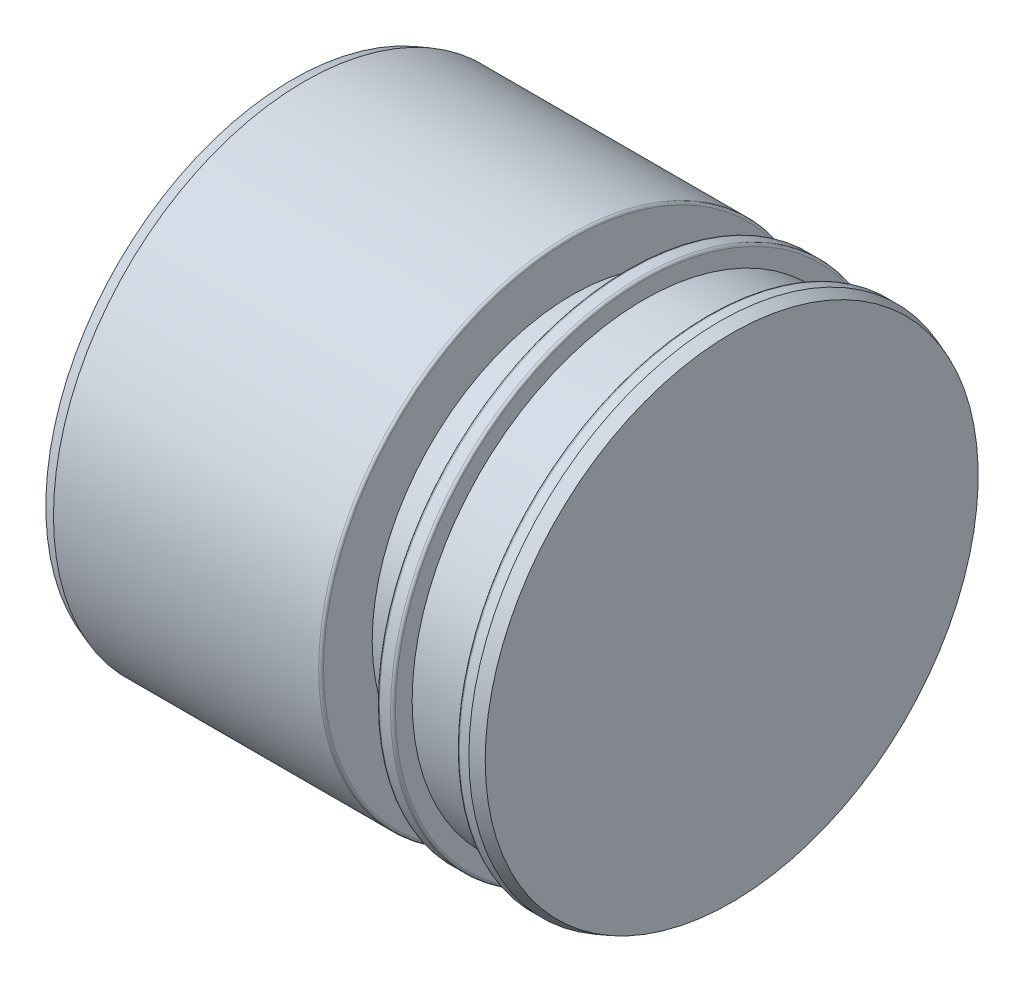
SolidWorks part; units mm, degrees
ref_plane "Face" through (0, 0, 0) normal (0, 0, 1) x (1, 0, 0)
ref_plane "Dessus" through (0, 0, 0) normal (0, 1, 0) x (1, 0, 0)
ref_plane "Droite" through (0, 0, 0) normal (1, 0, 0) x (0, 0, -1)
sketch "Esquisse1" plane through (0, 0, 0) normal (0, 0, 1) x (1, 0, 0)
  line L0 (0, 0) -> (50.2342, 0) construction
  line L1 (0, 0) -> (0, 31.4)
  line L2 (0, 31.4) -> (35, 31.4)
  line L3 (35, 31.4) -> (35, 25)
  line L4 (35, 25) -> (42, 25)
  line L5 (42, 25) -> (42, 31.4)
  line L6 (42, 31.4) -> (44, 31.4)
  line L7 (44, 31.4) -> (44, 29)
  line L8 (44, 29) -> (52, 29)
  line L9 (52, 29) -> (52, 31.4)
  line L10 (52, 31.4) -> (55, 31.4)
  line L11 (55, 31.4) -> (55, 0)
  line L12 (55, 0) -> (0, 0)
  dimension "D1" = 31.4
  dimension "D2" = 25
  dimension "D3" = 29
  dimension "D4" = 55
  dimension "D5" = 3
  dimension "D6" = 8
  dimension "D7" = 13
  dimension "D8" = 7
revolve "Révolution1" add sketch "Esquisse1" angle 360 about L0
sketch "Esquisse2" plane through (0, 0, 0) normal (0, 0, 1) x (1, 0, 0)
  line L0 (0, 0) -> (0, 20)
  line L1 (0, 31.4) -> (0, -31.4) construction
  line L2 (0, 20) -> (33.453, 20)
  line L3 (33.453, 20) -> (45, 0)
  line L4 (45, 0) -> (0, 0)
  dimension "D1" = 60
  dimension "D2" = 45
  dimension "D3" = 20
revolve "Enlèvement de matière-Révolution1" cut sketch "Esquisse2" angle 360 about L4
chamfer "Chanfrein1" distance 1.5 angle 20 1 edges at (0, 0, 31.4)
chamfer "Chanfrein2" distance 1.5 angle 20 1 edges at (55, 0, 31.4)
fillet "Congé1" radius 0.3 4 edges at (52, 0, 31.4) (42, 0, 31.4) (44, 0, 31.4) (35, 0, 31.4)
